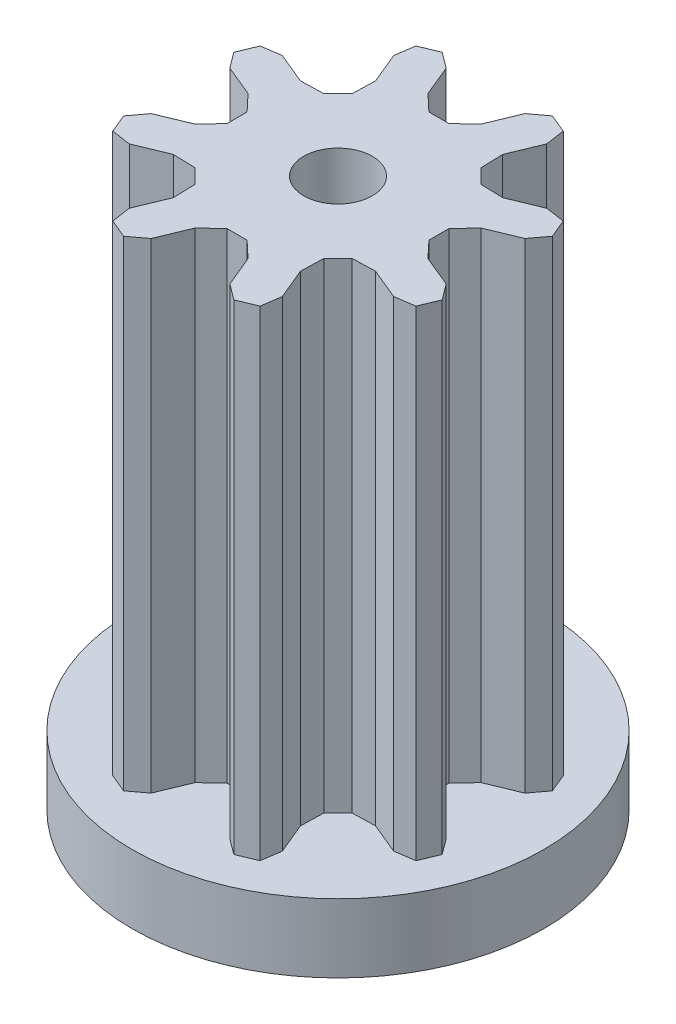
SolidWorks part; units mm, degrees
ref_plane "Front" through (0, 0, 0) normal (0, 0, 1) x (1, 0, 0)
ref_plane "Top" through (0, 0, 0) normal (0, 1, 0) x (1, 0, 0)
ref_plane "Right" through (0, 0, 0) normal (1, 0, 0) x (0, 0, -1)
sketch "Sketch1" plane through (0, 0, 0) normal (0, 0, 1) x (1, 0, 0)
  line L0 (0, -3.1686) -> (0, 13.5473) construction
  line L1 (0.5, 0) -> (3, 0)
  line L2 (0.5, 0) -> (0.5, 8)
  line L3 (0.5, 8) -> (3, 8)
  line L4 (3, 0) -> (3, 8)
  dimension "D1" = 2.5
  dimension "D2" = 8
  dimension "D3" = 8
  dimension "D4" = 3
revolve "Revolve1" add sketch "Sketch1" angle 360 about L0
sketch "Sketch3" plane through (0, 8, 0) normal (0, 1, 0) x (-1, 0, 0)
  line L0 (1.0735, 2.2093) -> (0.8031, 2.3213)
  line L1 (2.2093, 1.0735) -> (1.9268, 1.1149)
  line L2 (1.9268, 1.1149) -> (1.4737, 0.9272)
  line L3 (1.4737, 0.9272) -> (1.1437, 0.9368)
  line L4 (1.1437, 0.9368) -> (0.9368, 1.1437)
  line L5 (0.9368, 1.1437) -> (0.9272, 1.4737)
  line L6 (0.9272, 1.4737) -> (1.1149, 1.9268)
  line L7 (1.1149, 1.9268) -> (1.0735, 2.2093)
  line L8 (2.3213, 0.8031) -> (2.2093, 1.0735)
  line L9 (-0.8031, 2.3213) -> (-1.0735, 2.2093)
  line L10 (0.8031, 2.3213) -> (0.5741, 2.1508)
  line L11 (0.5741, 2.1508) -> (0.3865, 1.6977)
  line L12 (0.3865, 1.6977) -> (0.1463, 1.4712)
  line L13 (0.1463, 1.4712) -> (-0.1463, 1.4712)
  line L14 (-0.1463, 1.4712) -> (-0.3865, 1.6977)
  line L15 (-0.3865, 1.6977) -> (-0.5741, 2.1508)
  line L16 (-0.5741, 2.1508) -> (-0.8031, 2.3213)
  line L17 (2.3213, -0.8031) -> (2.1508, -0.5741)
  line L18 (2.1508, -0.5741) -> (1.6977, -0.3865)
  line L19 (1.6977, -0.3865) -> (1.4712, -0.1463)
  line L20 (1.4712, -0.1463) -> (1.4712, 0.1463)
  line L21 (1.4712, 0.1463) -> (1.6977, 0.3865)
  line L22 (1.6977, 0.3865) -> (2.1508, 0.5741)
  line L23 (2.1508, 0.5741) -> (2.3213, 0.8031)
  line L24 (2.2093, -1.0735) -> (2.3213, -0.8031)
  line L25 (1.0735, -2.2093) -> (1.1149, -1.9268)
  line L26 (1.1149, -1.9268) -> (0.9272, -1.4737)
  line L27 (0.9272, -1.4737) -> (0.9368, -1.1437)
  line L28 (0.9368, -1.1437) -> (1.1437, -0.9368)
  line L29 (1.1437, -0.9368) -> (1.4737, -0.9272)
  line L30 (1.4737, -0.9272) -> (1.9268, -1.1149)
  line L31 (1.9268, -1.1149) -> (2.2093, -1.0735)
  line L32 (0.8031, -2.3213) -> (1.0735, -2.2093)
  line L33 (-0.8031, -2.3213) -> (-0.5741, -2.1508)
  line L34 (-0.5741, -2.1508) -> (-0.3865, -1.6977)
  line L35 (-0.3865, -1.6977) -> (-0.1463, -1.4712)
  line L36 (-0.1463, -1.4712) -> (0.1463, -1.4712)
  line L37 (0.1463, -1.4712) -> (0.3865, -1.6977)
  line L38 (0.3865, -1.6977) -> (0.5741, -2.1508)
  line L39 (0.5741, -2.1508) -> (0.8031, -2.3213)
  line L40 (-1.0735, -2.2093) -> (-0.8031, -2.3213)
  line L41 (-2.2093, -1.0735) -> (-1.9268, -1.1149)
  line L42 (-1.9268, -1.1149) -> (-1.4737, -0.9272)
  line L43 (-1.4737, -0.9272) -> (-1.1437, -0.9368)
  line L44 (-1.1437, -0.9368) -> (-0.9368, -1.1437)
  line L45 (-0.9368, -1.1437) -> (-0.9272, -1.4737)
  line L46 (-0.9272, -1.4737) -> (-1.1149, -1.9268)
  line L47 (-1.1149, -1.9268) -> (-1.0735, -2.2093)
  line L48 (-2.3213, -0.8031) -> (-2.2093, -1.0735)
  line L49 (-2.3213, 0.8031) -> (-2.1508, 0.5741)
  line L50 (-2.1508, 0.5741) -> (-1.6977, 0.3865)
  line L51 (-1.6977, 0.3865) -> (-1.4712, 0.1463)
  line L52 (-1.4712, 0.1463) -> (-1.4712, -0.1463)
  line L53 (-1.4712, -0.1463) -> (-1.6977, -0.3865)
  line L54 (-1.6977, -0.3865) -> (-2.1508, -0.5741)
  line L55 (-2.1508, -0.5741) -> (-2.3213, -0.8031)
  line L56 (-2.2093, 1.0735) -> (-2.3213, 0.8031)
  line L57 (-1.0735, 2.2093) -> (-1.1149, 1.9268)
  line L58 (-1.1149, 1.9268) -> (-0.9272, 1.4737)
  line L59 (-0.9272, 1.4737) -> (-0.9368, 1.1437)
  line L60 (-0.9368, 1.1437) -> (-1.1437, 0.9368)
  line L61 (-1.1437, 0.9368) -> (-1.4737, 0.9272)
  line L62 (-1.4737, 0.9272) -> (-1.9268, 1.1149)
  line L63 (-1.9268, 1.1149) -> (-2.2093, 1.0735)
  circle A1 centre (0, 0) radius 3
extrude "Cut-Extrude1" cut sketch "Sketch3" against normal blind 7
